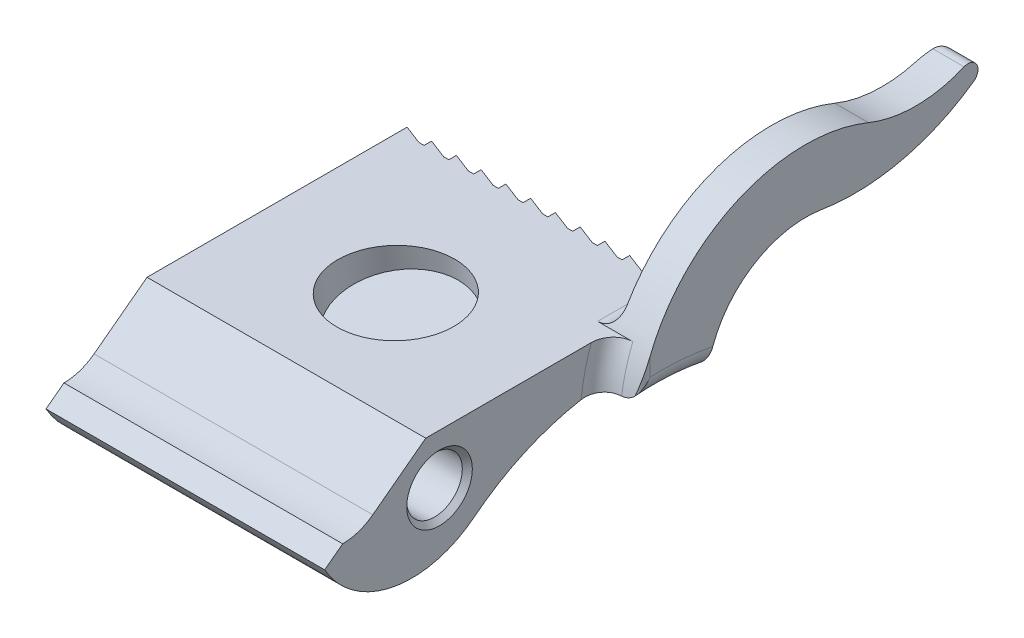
SolidWorks part; units mm, degrees
ref_plane "Спереди" through (0, 0, 0) normal (0, 0, 1) x (1, 0, 0)
ref_plane "Сверху" through (0, 0, 0) normal (0, 1, 0) x (1, 0, 0)
ref_plane "Справа" through (0, 0, 0) normal (1, 0, 0) x (0, 0, -1)
sketch "Эскиз1" plane through (0, 0, 0) normal (1, 0, 0) x (0, 0, -1)
  line L0 (-9.1069, -1.0742) -> (-7.6814, 0)
  line L1 (-7.6814, 0) -> (6.5859, 0) construction
  line L2 (-5.293, 0.7992) -> (-1.0952, 3.9624)
  line L3 (-1.0952, 3.9624) -> (19.5254, 3.9624)
  line L4 (19.5254, 3.9624) -> (20.0192, -0.0589)
  line L5 (0, 0) -> (0, -10.9813) construction
  circle A0 centre (0, 0) radius 2.2035
  arc A1 (-9.1069, -1.0742) -> (2.7349, -3.3872) centre (-2.1971, 2.8321) ccw
  arc A2 (2.7349, -3.3872) -> (20.0192, -0.0589) centre (14.5717, -18.3134) cw
  arc A3 (-7.6814, 0) -> (-5.293, 0.7992) centre (-7.6814, 3.9688) ccw
  point P9 (14.5717, 0.7366)
  point P11 (-2.1971, -5.1054)
  point P14 (-10.1346, 2.8321)
  dimension "D1" = 4.4069
  dimension "D3" = 7.9375
  dimension "D7" = 19.05
  dimension "D12" = 3.9688
  dimension "D2" = 37
  dimension "D4" = 3.9624
  dimension "D5" = 4.6228
  dimension "D6" = 5.1054
  dimension "D8" = 3.2258
  dimension "D9" = 7
  dimension "D10" = 19.8628
  dimension "D11" = 10.1346
extrude "Бобышка-Вытянуть1" add sketch "Эскиз1" against normal blind 22.098 from offset 11.1506
sketch "Эскиз2" plane through (-10.9474, 0, 0) normal (1, 0, 0) x (0, 0, -1)
  line L0 (19.5254, 3.9624) -> (-1.0952, 3.9624) construction
  arc A0 (12.8524, 0.6589) -> (18.2372, 0.3806) centre (14.5717, -18.3134) cw
  arc A1 (20.0192, -0.0589) -> (2.7349, -3.3872) centre (14.5717, -18.3134) ccw construction
  arc A2 (18.2372, 0.3806) -> (27.2623, 7.0108) centre (26.0059, -0.7366) cw
  arc A3 (12.8524, 0.6589) -> (30.9628, 11.125) centre (25.9438, -1.0922) cw
  arc A4 (30.9628, 11.125) -> (38.5465, 11.1641) centre (34.7078, 20.241) ccw
  arc A5 (27.2623, 7.0108) -> (39.3124, 9.7839) centre (29.8848, 23.1825) ccw
  arc A6 (39.3124, 9.7839) -> (38.5465, 11.1641) centre (38.8556, 10.433) ccw
  point P15 (25.9438, 12.1158)
  point P17 (38.8556, 11.2268)
  point P18 (26.0059, 7.112)
  point P19 (39.6494, 10.433)
  dimension "D3" = 13.208
  dimension "D4" = 7.8486
  dimension "D5" = 9.8552
  dimension "D6" = 16.383
  dimension "D7" = 0.7937
  dimension "D1" = 12.8524
  dimension "D2" = 18.2372
  dimension "D8" = 3.1496
  dimension "D9" = 8.1534
  dimension "D10" = 7.2644
  dimension "D11" = 39.6494
extrude "Бобышка-Вытянуть2" add sketch "Эскиз2" against normal blind 5.5562 from offset 25.146
sketch "Эскиз3" plane through (14.1986, 0, 0) normal (-1, 0, 0) x (0, 0, 1)
  line L0 (-20.0192, -0.0589) -> (-19.5537, 3.7322)
  line L3 (-20.0192, -0.0589) -> (-19.5537, 3.7322) construction
  arc A0 (-19.5537, 3.7322) -> (-18.2372, 0.3806) centre (-26.0059, -0.7366) cw
  arc A1 (-18.2372, 0.3806) -> (-20.0192, -0.0589) centre (-14.5717, -18.3134) ccw
  arc A4 (-18.2372, 0.3806) -> (-27.2623, 7.0108) centre (-26.0059, -0.7366) ccw construction
  arc A6 (-18.2372, 0.3806) -> (-20.0192, -0.0589) centre (-14.5717, -18.3134) ccw construction
extrude "Вырез-Вытянуть1" cut sketch "Эскиз3" along normal blind 5.5562
fillet "Скругление1" radius 1.5875 1 edges at (11.1506, 2.3395, -13.1894)
sketch "Эскиз4" plane through (8.6424, 0, 0) normal (1, 0, 0) x (0, 0, -1)
  line L0 (19.5254, 3.9624) -> (-1.0952, 3.9624) construction
  line L1 (39.6494, 12.1158) -> (13.7413, 12.1158)
  line L2 (39.6494, 12.1158) -> (39.6494, 3.9624)
  line L3 (39.6494, 3.9624) -> (13.7413, 3.9624)
  line L4 (13.7413, 12.1158) -> (13.7413, 3.9624)
  arc A0 (30.9628, 11.125) -> (12.8524, 0.6589) centre (25.9438, -1.0922) ccw construction
  arc A2 (39.3124, 9.7839) -> (38.5465, 11.1641) centre (38.8556, 10.433) ccw construction
extrude "Вырез-Вытянуть2" cut sketch "Эскиз4" along normal offset from surface (2.8892 mm away) 2.667
fillet "Скругление3" radius 1.5875 2 edges at (11.5316, 3.9624, -16.7303) (14.1986, 0.7112, -15.5547)
sketch "Эскиз5" plane through (0, 3.9624, 0) normal (0, 1, 0) x (1, 0, 0)
  line L0 (14.1986, 13.6468) -> (14.1986, 12.8531)
  line L1 (14.1986, 12.8531) -> (13.4048, 12.8531)
  line L2 (12.3253, 39.6494) -> (11.5316, 39.6494)
  line L3 (11.5316, 39.6494) -> (11.5316, 37.4043)
  line L4 (14.1986, 39.6494) -> (11.5316, 39.6494) construction
  line L5 (11.5316, 38.5465) -> (11.5316, 30.9628) construction
  line L6 (14.1986, 13.1727) -> (14.1986, 30.9628) construction
  arc A0 (14.1986, 13.6468) -> (13.4048, 12.8531) centre (13.4048, 13.6468) cw
  arc A1 (12.3253, 39.6494) -> (11.5316, 37.4043) centre (15.1035, 37.4043) ccw
  dimension "D1" = 0.7937
  dimension "D2" = 3.5719
  dimension "D3" = 0.7937
extrude "Вырез-Вытянуть3" cut sketch "Эскиз5" against normal mid plane 25.4
chamfer "Фаска1" distance 0.3969 angle 45 2 edges at (-10.9474, 0, -2.2035) (11.1506, 0, -2.2035)
sketch "Эскиз6" plane through (0, 3.9624, 0) normal (0, 1, 0) x (1, 0, 0)
  line L0 (-10.9474, 19.5254) -> (-9.4255, 18.9412)
  line L1 (-9.4255, 18.9412) -> (-9.017, 18.9412)
  line L2 (-9.017, 18.9412) -> (-9.017, 19.5254)
  line L3 (-10.9474, 19.5254) -> (8.6424, 19.5254) construction
  line L4 (-9.017, 19.5254) -> (-10.9474, 19.5254)
  line L5 (-8.984, 19.5254) -> (-7.4621, 18.9412)
  line L6 (-7.4621, 18.9412) -> (-7.0536, 18.9412)
  line L7 (-7.0536, 18.9412) -> (-7.0536, 19.5254)
  line L8 (-7.0536, 19.5254) -> (-8.984, 19.5254)
  line L9 (-7.0206, 19.5254) -> (-5.4987, 18.9412)
  line L10 (-5.4987, 18.9412) -> (-5.0902, 18.9412)
  line L11 (-5.0902, 18.9412) -> (-5.0902, 19.5254)
  line L12 (-5.0902, 19.5254) -> (-7.0206, 19.5254)
  line L13 (-5.0571, 19.5254) -> (-3.5352, 18.9412)
  line L14 (-3.5352, 18.9412) -> (-3.1267, 18.9412)
  line L15 (-3.1267, 18.9412) -> (-3.1267, 19.5254)
  line L16 (-3.1267, 19.5254) -> (-5.0571, 19.5254)
  line L17 (-3.0937, 19.5254) -> (-1.5718, 18.9412)
  line L18 (-1.5718, 18.9412) -> (-1.1633, 18.9412)
  line L19 (-1.1633, 18.9412) -> (-1.1633, 19.5254)
  line L20 (-1.1633, 19.5254) -> (-3.0937, 19.5254)
  line L21 (-1.1303, 19.5254) -> (0.3916, 18.9412)
  line L22 (0.3916, 18.9412) -> (0.8001, 18.9412)
  line L23 (0.8001, 18.9412) -> (0.8001, 19.5254)
  line L24 (0.8001, 19.5254) -> (-1.1303, 19.5254)
  line L25 (0.8331, 19.5254) -> (2.355, 18.9412)
  line L26 (2.355, 18.9412) -> (2.7635, 18.9412)
  line L27 (2.7635, 18.9412) -> (2.7635, 19.5254)
  line L28 (2.7635, 19.5254) -> (0.8331, 19.5254)
  line L29 (2.7965, 19.5254) -> (4.3184, 18.9412)
  line L30 (4.3184, 18.9412) -> (4.7269, 18.9412)
  line L31 (4.7269, 18.9412) -> (4.7269, 19.5254)
  line L32 (4.7269, 19.5254) -> (2.7965, 19.5254)
  line L33 (4.76, 19.5254) -> (6.2819, 18.9412)
  line L34 (6.2819, 18.9412) -> (6.6904, 18.9412)
  line L35 (6.6904, 18.9412) -> (6.6904, 19.5254)
  line L36 (6.6904, 19.5254) -> (4.76, 19.5254)
  line L37 (6.7234, 19.5254) -> (8.2453, 18.9412)
  line L38 (8.2453, 18.9412) -> (8.6538, 18.9412)
  line L39 (8.6538, 18.9412) -> (8.6538, 19.5254)
  line L40 (8.6538, 19.5254) -> (6.7234, 19.5254)
  line L41 (-10.9474, 19.5254) -> (-8.984, 19.5254) construction
  dimension "D1" = 21
  dimension "D2" = 1.9304
  dimension "D3" = 0.5842
  dimension "D5" = 1.9634
  dimension "D4" = 10
extrude "Вырез-Вытянуть8" cut sketch "Эскиз6" along direction (0, 0.9925, 0.1219) on the side against the normal through all
sketch "Эскиз7" plane through (-10.9474, 0, 0) normal (-1, 0, 0) x (0, 0, 1)
  line L0 (-19.8644, 1.2017) -> (-19.2846, 1.1305) construction
  line L1 (-20.0192, -0.0589) -> (-19.5254, 3.9624) construction
  line L2 (-19.7866, 1.8351) -> (-19.9422, 0.5682)
  line L3 (-19.9422, 0.5682) -> (-19.3047, 0.9666)
  line L4 (-19.3047, 0.9666) -> (-19.2645, 1.2943)
  line L5 (-19.2645, 1.2943) -> (-19.7866, 1.8351)
  line L6 (-19.57, 3.5998) -> (-19.7255, 2.333)
  line L7 (-19.7255, 2.333) -> (-19.088, 2.7313)
  line L8 (-19.088, 2.7313) -> (-19.0478, 3.0591)
  line L9 (-19.0478, 3.0591) -> (-19.57, 3.5998)
  line L10 (-19.7866, 1.8351) -> (-19.57, 3.5998) construction
  dimension "D1" = 78
  dimension "D2" = 0.3302
  dimension "D3" = 0.5842
  dimension "D4" = 1.27
  dimension "D6" = 1.778
  dimension "D5" = 2
extrude "Вырез-Вытянуть9" cut sketch "Эскиз7" against normal up to surface (19.6012 mm away)
sketch "Эскиз8" plane through (0, 0, 0) normal (1, 0, 0) x (0, 0, -1)
  line L0 (0, 0) -> (0, 11.5313) construction
  line L1 (8.7023, -1.8144) -> (6.4028, 11.2267) construction
  line L2 (8.1044, 1.5766) -> (12.6319, 2.3749)
  line L3 (12.6319, 2.3749) -> (11.7953, 7.1193)
  line L4 (11.7953, 7.1193) -> (7.2678, 6.3209)
  line L5 (7.2678, 6.3209) -> (8.1044, 1.5766)
  line L6 (19.5254, 3.9624) -> (-1.0952, 3.9624) construction
  dimension "D1" = 10
  dimension "D2" = 8.255
  dimension "D3" = 9.1948
  dimension "D4" = 1.5875
revolve "Вырез-Повернуть1" cut sketch "Эскиз8" angle 360 about L1
